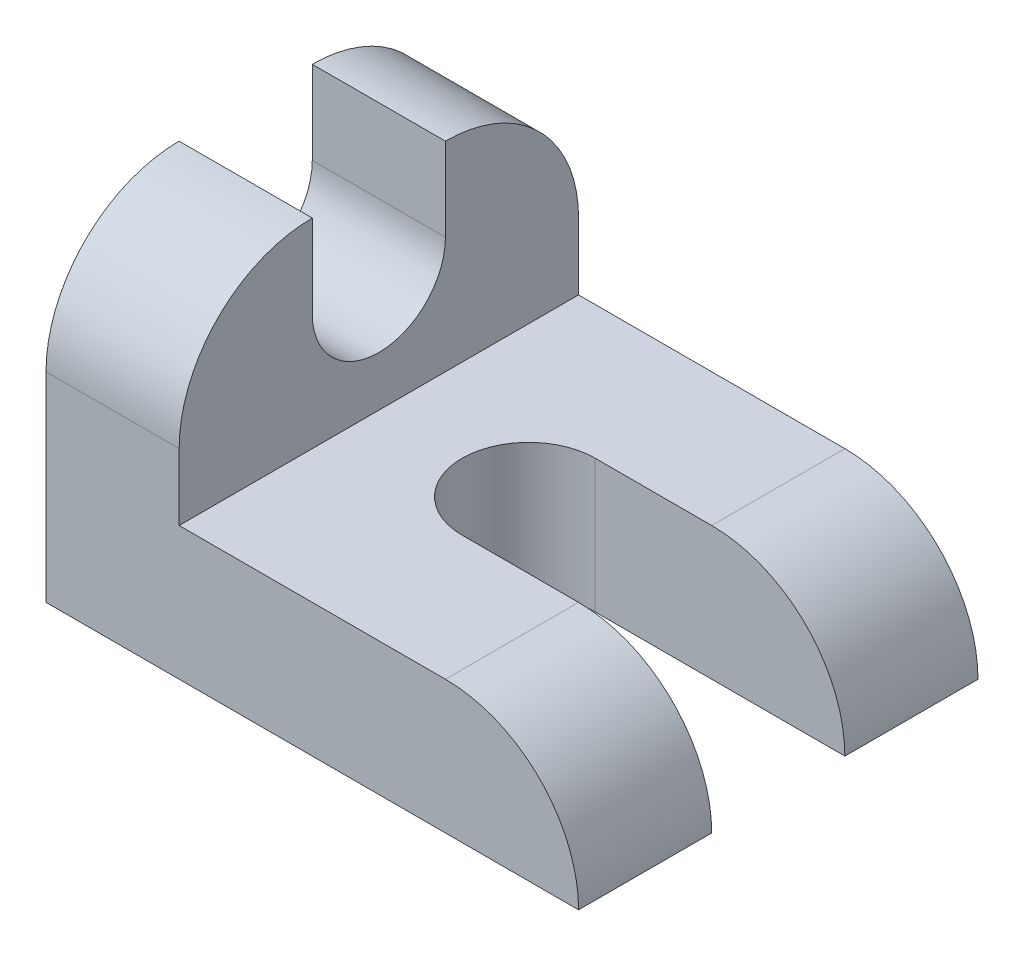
SolidWorks part; units mm, degrees
ref_plane "Front" through (0, 0, 0) normal (0, 0, 1) x (1, 0, 0)
ref_plane "Top" through (0, 0, 0) normal (0, 1, 0) x (1, 0, 0)
ref_plane "Right" through (0, 0, 0) normal (1, 0, 0) x (0, 0, -1)
sketch "Sketch1" plane through (0, 0, 0) normal (0, 0, 1) x (1, 0, 0)
  line L0 (0, 127) -> (0, 0)
  line L1 (0, 0) -> (203.2, 0)
  dimension "D1" = 127
  dimension "D2" = 203.2
extrude "Base-Extrude-Thin" add sketch "Sketch1" against normal mid plane 152.4 thin
fillet "Fillet1" radius 50.8 5 edges at (25.4, 127, -76.2) (25.4, 127, 76.2) (203.2, 25.4, 76.2) (203.2, 25.4, -76.2) (203.2, 50.8, 0)
sketch "Sketch2" plane through (50.8, 0, 0) normal (1, 0, 0) x (0, 0, -1)
  line L0 (0, 127) -> (0, 50.8) construction
  line L1 (0, 50) -> (0, -50) construction
  line L2 (76.2, 50.8) -> (-76.2, 50.8) construction
  line L3 (25.4, 127) -> (-25.4, 127) construction
  line L4 (-25.4, 127) -> (-25.4, 95.25)
  line L5 (25.4, 127) -> (25.4, 95.25)
  line L6 (-25.4, 127) -> (25.4, 127)
  arc A0 (-25.4, 95.25) -> (25.4, 95.25) centre (0, 95.25) ccw
  dimension "D2" = 31.75
extrude "Cut-Extrude1" cut sketch "Sketch2" against normal through all
sketch "Sketch3" plane through (97.6997, 0, 87.6999) normal (0, -1, 0) x (0, 0, -1)
  line L0 (87.6999, 105.5003) -> (87.6999, -97.6997) construction
  line L4 (62.2999, 105.5003) -> (62.2999, 10.2503)
  line L5 (113.0999, 105.5003) -> (113.0999, 10.2503)
  line L6 (62.2999, 105.5003) -> (113.0999, 105.5003)
  line L7 (163.8999, 105.5003) -> (11.4999, 105.5003) construction
  line L8 (163.8999, -97.6997) -> (11.4999, -97.6997) construction
  arc A0 (62.2999, 10.2503) -> (113.0999, 10.2503) centre (87.6999, 10.2503) ccw
  dimension "D2" = 95.25
extrude "Cut-Extrude2" cut sketch "Sketch3" against normal through all
